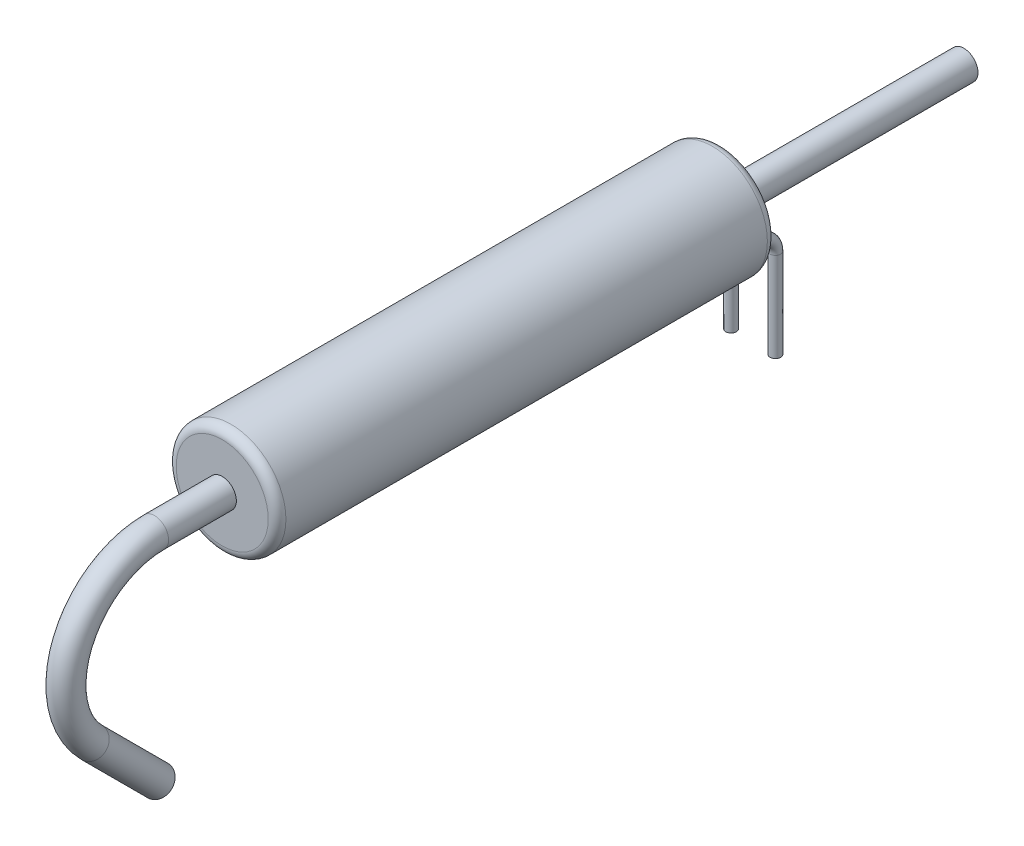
SolidWorks part; units mm, degrees
ref_plane "Front Plane" through (0, 0, 0) normal (0, 0, 1) x (1, 0, 0)
ref_plane "Top Plane" through (0, 0, 0) normal (0, 1, 0) x (1, 0, 0)
ref_plane "Right Plane" through (0, 0, 0) normal (1, 0, 0) x (0, 0, -1)
imported_body "Imported3"
sketch "Sketch1" plane through (0, -2.55, 0) normal (0, -1, 0) x (1, 0, 0)
  circle A0 centre (-1.25, -1.8) radius 0.3
extrude "Boss-Extrude1" add sketch "Sketch1" along normal blind 5.05
sketch "Sketch2" plane through (0, -2.55, 0) normal (0, -1, 0) x (1, 0, 0)
  circle A0 centre (1.25, -1.8) radius 0.3
extrude "Boss-Extrude2" add sketch "Sketch2" along normal blind 5.05
sketch "Sketch3" plane through (0, 0, 0) normal (0, 0, -1) x (-1, 0, 0)
  circle A0 centre (0, 0) radius 0.8
extrude "Boss-Extrude3" add sketch "Sketch3" along normal blind 26.7
fillet "Fillet1" radius 0.5 2 edges at (3.1, 0, 28.2) (3.1, 0, 0)
sketch "Sketch6" plane through (0, 0, -26.7) normal (0, 0, -1) x (-1, 0, 0)
  circle A0 centre (0, 0) radius 0.8
extrude "Cut-Extrude2" cut sketch "Sketch6" against normal blind 13
sketch "Sketch4" plane through (0, 0, 28.2) normal (0, 0, 1) x (1, 0, 0)
  circle A0 centre (0, 0) radius 0.8
sketch "Sketch7" plane through (0, 0, 0) normal (1, 0, 0) x (0, 0, -1)
  line L0 (-28.2, 0) -> (-32.0289, 0)
  line L1 (-33.6087, -10.4913) -> (-35.5645, -8.5355)
  line L2 (-28.2, 0.8) -> (-28.2, -0.8) construction
  line L3 (-33.6087, -10.4913) -> (-31.841, -12.259)
  arc A0 (-35.5645, -8.5355) -> (-32.0289, 0) centre (-32.0289, -5) cw
  dimension "D1" = 5
sweep "Sweep1" add profiles "Sketch4" path "Sketch7"
